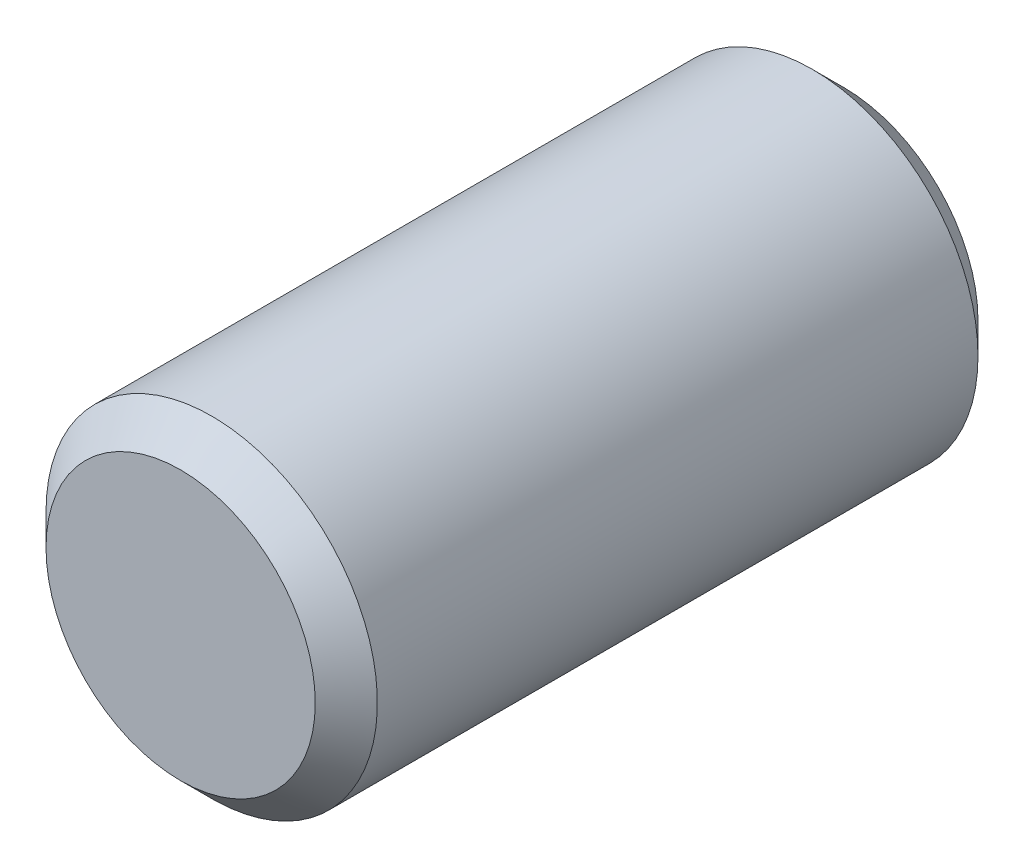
SolidWorks part; units mm, degrees
ref_plane "Face" through (0, 0, 0) normal (0, 0, 1) x (1, 0, 0)
ref_plane "Dessus" through (0, 0, 0) normal (0, 1, 0) x (1, 0, 0)
ref_plane "Droite" through (0, 0, 0) normal (1, 0, 0) x (0, 0, -1)
sketch "Esquisse1" plane through (0, 0, 0) normal (0, 0, 1) x (1, 0, 0)
  circle A0 centre (0, 0) radius 8
  dimension "D1" = 16
extrude "Base-Extrusion" add sketch "Esquisse1" along normal blind 32
chamfer "Chanfrein1" distance 1.5 angle 45
